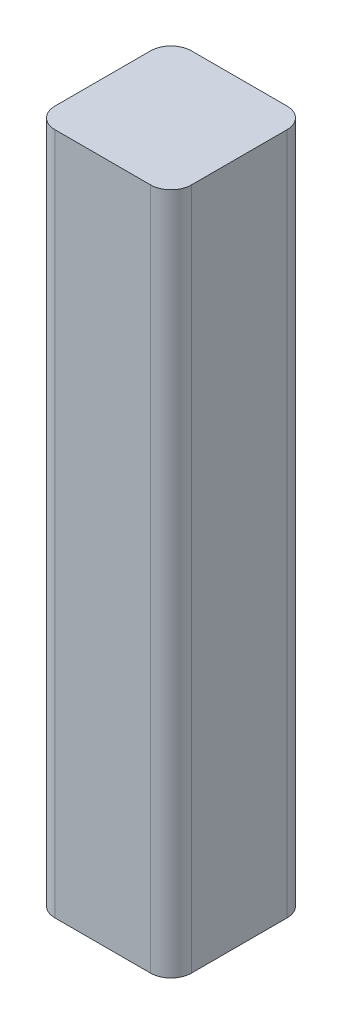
SolidWorks part; units mm, degrees
ref_plane "Front Plane" through (0, 0, 0) normal (0, 0, 1) x (1, 0, 0)
ref_plane "Top Plane" through (0, 0, 0) normal (0, 1, 0) x (1, 0, 0)
ref_plane "Right Plane" through (0, 0, 0) normal (1, 0, 0) x (0, 0, -1)
sketch "Sketch1" plane through (0, 0, 0) normal (0, 1, 0) x (1, 0, 0)
  line L1 (10, -10) -> (-10, -10)
  line L2 (10, -10) -> (10, 10)
  line L3 (10, 10) -> (-10, 10)
  line L4 (-10, -10) -> (-10, 10)
  line L5 (10, -10) -> (-10, 10) construction
  line L6 (10, 10) -> (-10, -10) construction
  point P0 (0, 0)
  dimension "D1" = 20
extrude "Boss-Extrude1" add sketch "Sketch1" along normal blind 100
fillet "Fillet1" radius 3 4 edges at (10, 50, -10) (10, 50, 10) (-10, 50, 10) (-10, 50, -10)
